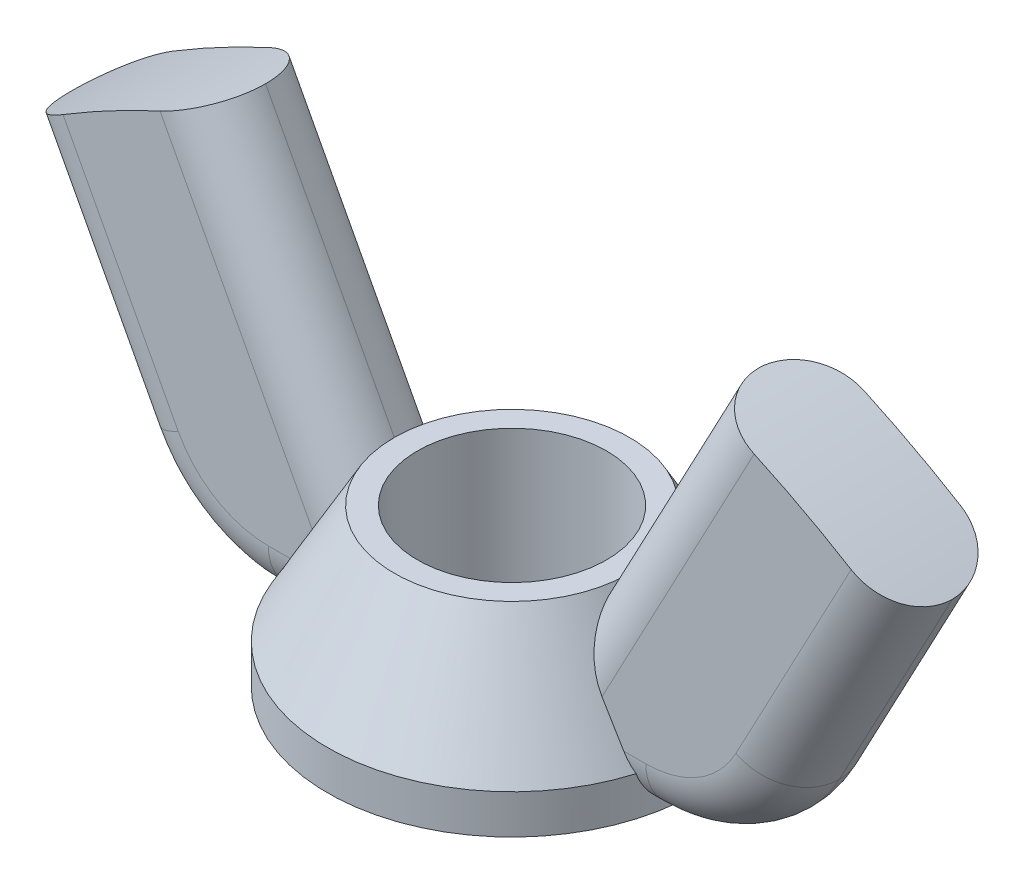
SolidWorks part; units mm, degrees
ref_plane "Plan de face" through (0, 0, 0) normal (0, 0, 1) x (1, 0, 0)
ref_plane "Plan de dessus" through (0, 0, 0) normal (0, 1, 0) x (1, 0, 0)
ref_plane "Plan de droite" through (0, 0, 0) normal (1, 0, 0) x (0, 0, -1)
sketch "Esquisse1" plane through (0, 0, 0) normal (0, 0, 1) x (1, 0, 0)
  line L0 (0, 47.3464) -> (0, -36.992) construction
  line L1 (-47.6804, 0) -> (60.5399, 0) construction
  line L2 (-1.3758, 4) -> (11.2493, 4) construction
  line L3 (4.7, -1.7968) -> (4.7, 6.0033) construction
  line L4 (3, 6.0033) -> (3, 3.3731) construction
  line L5 (1.2327, 1) -> (10.0546, 1) construction
  line L6 (3, 4) -> (4.7, 1) construction
  line L7 (3, 4) -> (4.7, 1)
  line L8 (4.7, 0) -> (0, 0)
  line L9 (0, 0) -> (0, 4)
  line L10 (0, 4) -> (3, 4)
  line L11 (4.7, 1) -> (4.7, 0)
revolve "Révolution1" add sketch "Esquisse1" angle 360 about L0
sketch "Esquisse2" plane through (0, 0, 0) normal (0, 0, 1) x (1, 0, 0)
  line L0 (6.5233, 4) -> (-5.3938, 4) construction
  line L1 (11.9135, 0) -> (4.4562, 0) construction
  line L2 (1.9031, 10.2) -> (15.6326, 10.2) construction
  line L3 (6.2805, 10.1698) -> (3, 4)
  line L4 (2.9997, 0) -> (4.8121, 0)
  line L5 (-6.2805, 10.1698) -> (-3, 4)
  line L6 (0, -4.7251) -> (0, 16.9028) construction
  line L7 (-8.3439, 2.1221) -> (-11.225, 7.5407)
  line L8 (-2.9997, 0) -> (-4.8121, 0)
  line L9 (-3, 4) -> (-2.9997, 0)
  line L12 (2.9997, -0.3295) -> (3.0007, 8.3006) construction
  line L15 (3, 4) -> (6.2805, 10.1698) construction
  line L16 (7.04, -0.3302) -> (11.9888, 8.9772) construction
  line L17 (6.2805, 10.1698) -> (11.225, 7.5407) construction
  line L18 (6.2805, 10.1698) -> (3, 4) construction
  line L19 (3, 4) -> (2.9997, 0)
  line L21 (8.3439, 2.1221) -> (11.225, 7.5407)
  arc A0 (8.3439, 2.1221) -> (4.8121, 0) centre (4.8121, 4) cw
  arc A1 (-6.2805, 10.1698) -> (-11.225, 7.5407) centre (2.5011, -12.3102) ccw
  arc A2 (6.2805, 10.1698) -> (11.225, 7.5407) centre (-2.5011, -12.3102) cw
  arc A3 (-8.3439, 2.1221) -> (-4.8121, 0) centre (-4.8121, 4) ccw
  dimension "D3" = 4
  dimension "D1" = 118
  dimension "D2" = 5.6
extrude "Extrusion1" add sketch "Esquisse2" along normal mid plane 2.8
sketch "Esquisse3" plane through (0, 0, 0) normal (0, -1, 0) x (1, 0, 0)
  circle A0 centre (0, 0) radius 2.41
extrude "Enlèv. mat.-Extru.1" cut sketch "Esquisse3" against normal through all
fillet "Congé1" radius 1.4 44 edges at (3, 3.8956, -0.5988) (3, 3.897, 0.5947) (4.6494, 0, -1.4) (3, 3.726, -1.4) (3, 4, -0.7) (3, 4, 0.7) (4.4866, 0.5, 1.4) (4.6494, 0, 1.4) (6.8723, 0.5713, 1.4) (9.7845, 4.8314, 1.4) (4.6403, 7.0849, 1.4) (3, 3.726, 1.4) (6.8723, 0.5713, -1.4) (4.8121, 0, 0) (9.7845, 4.8314, -1.4) (8.3439, 2.1221, 0) (11.225, 7.5407, 0) (4.6403, 7.0849, -1.4) (6.2805, 10.1698, 0) (4.4866, 0.5, -1.4) (-4.6494, 0, -1.4) (-4.8121, 0, 0) (-3, 3.8956, 0.5988) (-3, 3.897, -0.5947) (-3, 3.726, -1.4) (-3, 3.726, 1.4) (-4.6403, 7.0849, 1.4) (-9.7845, 4.8314, 1.4) (-6.8723, 0.5713, 1.4) (-4.6494, 0, 1.4) (-4.4866, 0.5, -1.4) (-6.2805, 10.1698, 0) (-9.7845, 4.8314, -1.4) (-11.225, 7.5407, 0) (-6.8723, 0.5713, -1.4) (-8.3439, 2.1221, 0) (-4.6403, 7.0849, -1.4) (-3, 4, 0.7) (-3, 4, -0.7) (-4.4866, 0.5, 1.4)
